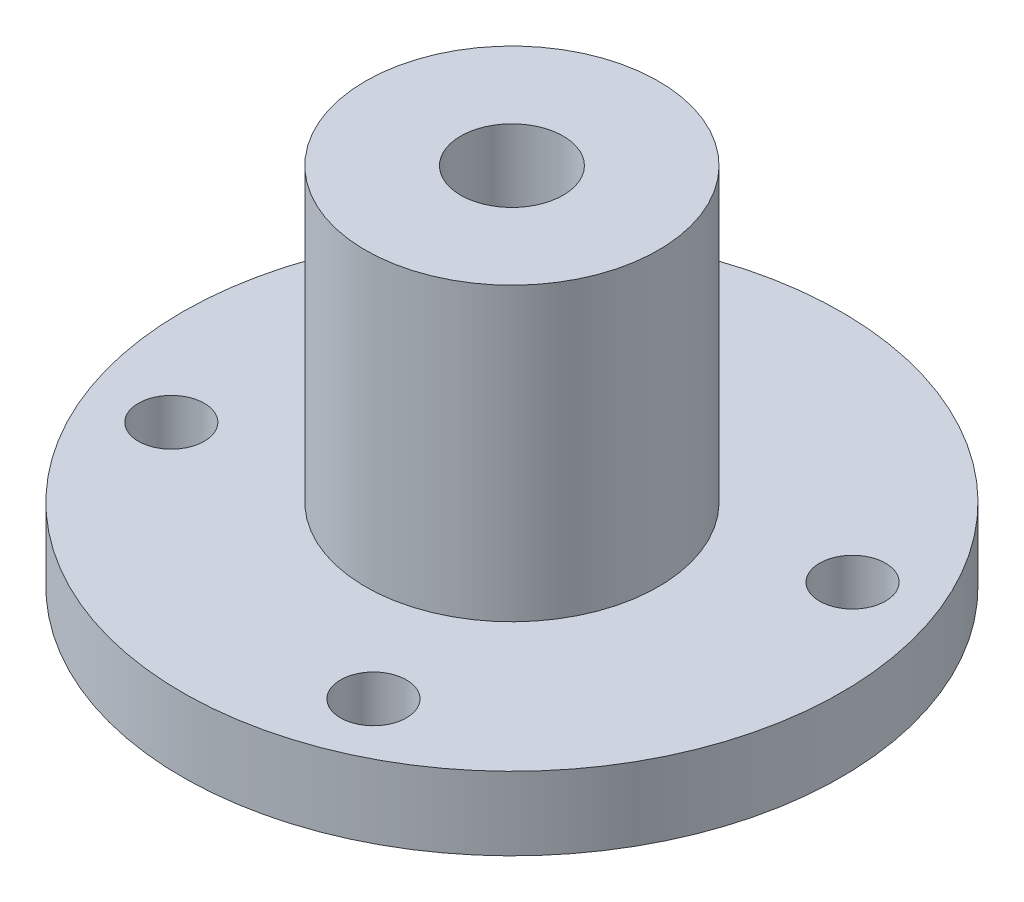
SolidWorks part; units mm, degrees
ref_plane "Plan de face" through (0, 0, 0) normal (0, 0, 1) x (1, 0, 0)
ref_plane "Plan de dessus" through (0, 0, 0) normal (0, 1, 0) x (1, 0, 0)
ref_plane "Plan de droite" through (0, 0, 0) normal (1, 0, 0) x (0, 0, -1)
sketch "Esquisse1" plane through (0, 0, 0) normal (0, 0, 1) x (1, 0, 0)
  line L0 (0, 49.8) -> (0, 10)
  line L1 (15, 0) -> (45, 0)
  line L2 (45, 0) -> (45, 10)
  line L3 (45, 10) -> (20, 10)
  line L4 (20, 10) -> (20, 49.8)
  line L5 (20, 49.8) -> (0, 49.8)
  line L6 (15, 0) -> (15, 10)
  line L7 (15, 10) -> (0, 10)
  dimension "D1" = 10
  dimension "D2" = 20
  dimension "D3" = 39.8
  dimension "D4" = 15
  dimension "D5" = 45
  dimension "D6" = 49.8
revolve "Révolution1" add sketch "Esquisse1" angle 360 about L0
hole_wizard "Trou taraudé M161" positions "Esquisse3" profile "Esquisse2" tap size "M16" standard "ISO"
sketch "Esquisse3" plane through (0, 49.8, 0) normal (0, 1, 0) x (-1, 0, 0)
  point P0 (0, 0)
sketch "Esquisse2" plane through (0, 49.8, 0) normal (1, 0, 0) x (0, 0, 1)
  line L0 (0, 0) -> (0, 49.8)
  line L1 (0, 49.8) -> (7, 49.8)
  line L2 (7, 49.8) -> (7, 0)
  line L5 (7, 0) -> (0, 0)
  line L11 (0, -6.35) -> (0, 107.95) construction
  dimension "Diamètre du trou pour taraudage jusqu'au prochain" = 14
  dimension "Profondeur du trou pour taraudage jusqu'au prochain" = 49.8
hole_wizard "Diamètre du perçage Ø9.0 (9)1" positions "Esquisse5" profile "Esquisse4" hole size "Ø9.0" standard "ISO"
sketch "Esquisse5" plane through (0, 10, 0) normal (0, 1, 0) x (-1, 0, 0)
  circle A0 centre (0, 0) radius 35.5
  point P0 (13.801, -32.7075)
  dimension "D1" = 71
sketch "Esquisse4" plane through (-13.801, 10, -32.7075) normal (1, 0, 0) x (0, 0, 1)
  line L0 (0, 0) -> (0, 10)
  line L1 (0, 10) -> (4.5, 10)
  line L2 (4.5, 10) -> (4.5, 0)
  line L5 (4.5, 0) -> (0, 0)
  line L11 (0, -6.35) -> (0, 107.95) construction
  dimension "Diamètre du perçage jusqu'au prochain" = 9
  dimension "Profondeur du perçage jusqu'au prochain" = 10
pattern_circular "Répétition circulaire1" count 4 every 90 about axis through (0, 0, 0) along (0, 1, 0) of "Diamètre du perçage Ø9.0 (9)1"
